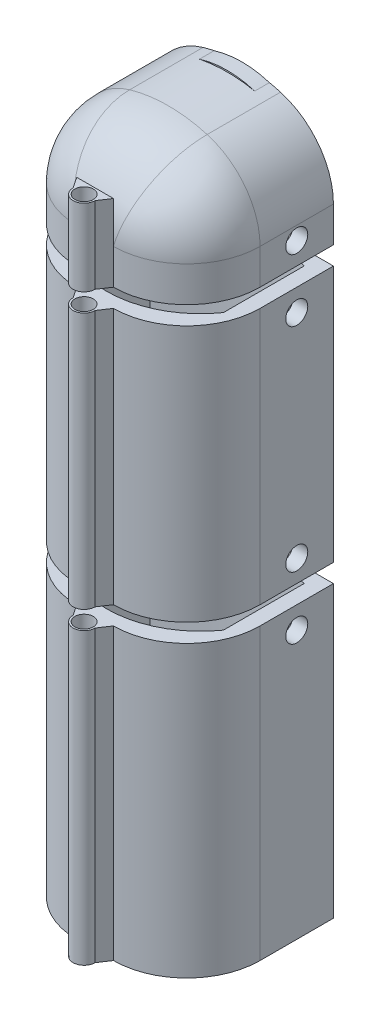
SolidWorks part; units mm, degrees
ref_plane "Alzado" through (0, 0, 0) normal (0, 0, 1) x (1, 0, 0)
ref_plane "Planta" through (0, 0, 0) normal (0, 1, 0) x (1, 0, 0)
ref_plane "Vista lateral" through (0, 0, 0) normal (1, 0, 0) x (0, 0, -1)
sketch "Croquis1" plane through (0, 0, 0) normal (0, 0, 1) x (1, 0, 0)
  line L1 (-18.6681, -47.5) -> (6.3319, -47.5)
  line L2 (-18.6681, -47.5) -> (-18.6681, 42.5)
  line L4 (6.3319, -47.5) -> (6.3319, 42.5)
  arc A0 (-18.6681, 42.5) -> (6.3319, 42.5) centre (-6.1681, 28.2195) cw
  point P0 (-2.2125, 0)
  dimension "D1" = 90
  dimension "D2" = 25
  dimension "D3" = 90
extrude "Saliente-Extruir1" add sketch "Croquis1" along normal blind 20
fillet "Redondeo1" radius 10 2 edges at (-18.6681, 42.5, 10) (6.3319, 42.5, 10)
fillet "Redondeo2" radius 10 5 edges at (-18.6681, -5.3285, 20) (-16.6633, 42.8494, 20) (-6.1681, 47.198, 20) (4.327, 42.8494, 20) (6.3319, -5.3285, 20)
sketch "Croquis2" plane through (0, 0, 20) normal (0, 0, 1) x (1, 0, 0)
  line L0 (-18.6681, 32.0235) -> (6.3319, 32.0235)
  line L4 (6.3319, 36.8429) -> (6.3319, -47.5) construction
  line L5 (-18.6681, -47.5) -> (-18.6681, 36.8429) construction
  line L7 (6.3319, 32.0235) -> (6.3319, 29.5235)
  line L8 (6.3319, 29.5235) -> (-18.6681, 29.5235)
  line L9 (-18.6681, 32.0235) -> (-18.6681, 29.5235)
  line L13 (6.3319, -5.4765) -> (-18.6681, -5.4765)
  line L14 (6.3319, -5.4765) -> (6.3319, -7.9765)
  line L15 (6.3319, -7.9765) -> (-18.6681, -7.9765)
  line L16 (-18.6681, -5.4765) -> (-18.6681, -7.9765)
  dimension "D2" = 2.5
  dimension "D4" = 2.5
extrude "Cortar-Extruir1" cut sketch "Croquis2" against normal blind 20
sketch "Croquis4" plane through (0, 0, 0) normal (0, 0, -1) x (-1, 0, 0)
  line L0 (18.6681, -47.5) -> (-6.3319, -47.5) construction
  line L2 (-4.3319, 37.5) -> (-4.3319, -47.5)
  line L3 (-4.3319, -47.5) -> (16.6681, -47.5)
  line L4 (16.6681, 32.5) -> (16.6681, -47.5)
  line L5 (-6.3319, -5.4765) -> (-6.3319, 29.5235) construction
  line L6 (18.6681, 29.5235) -> (18.6681, -5.4765) construction
  arc A0 (-4.3319, 37.5) -> (16.6681, 32.5) centre (6.1681, 35) cw
  dimension "D1" = 2
  dimension "D2" = 2
  dimension "D3" = 80
extrude "Cortar-Extruir2" cut sketch "Croquis4" against normal blind 13
sketch "Croquis6" plane through (0, -47.5, 0) normal (0, -1, 0) x (1, 0, 0)
  line L0 (-8.6681, 20) -> (-3.6681, 20) construction
  line L1 (-7.6681, 21.5) -> (-8.6681, 20)
  line L2 (-4.6681, 21.5) -> (-3.6681, 20)
  line L3 (-3.6681, 20) -> (-8.6681, 20)
  line L8 (-3.6681, 0) -> (-8.6681, 0)
  line L9 (-4.6681, -1.5) -> (-3.6681, 0)
  line L10 (-7.6681, -1.5) -> (-8.6681, 0)
  arc A0 (-4.6681, 21.5) -> (-7.6681, 21.5) centre (-6.1681, 21.5) ccw
  arc A1 (6.3319, 10) -> (-3.6681, 20) centre (-3.6681, 10) ccw construction
  arc A2 (-4.6681, -1.5) -> (-7.6681, -1.5) centre (-6.1681, -1.5) cw
  dimension "D1" = 3
  dimension "D2" = 1.5
extrude "Saliente-Extruir2" add sketch "Croquis6" against normal blind 90
sketch "Croquis7" plane through (0, -47.5, 0) normal (0, -1, 0) x (1, 0, 0)
  circle A0 centre (-6.1681, 21.5) radius 1.25
  dimension "D1" = 2.5
extrude "Cortar-Extruir3" cut sketch "Croquis7" against normal blind 90
sketch "Croquis8" plane through (0, 0, 0) normal (0, 0, -1) x (-1, 0, 0)
  line L1 (-6.3319, 32.0235) -> (18.6681, 32.0235)
  line L2 (-6.3319, 32.0235) -> (-6.3319, 29.5235)
  line L3 (-6.3319, 29.5235) -> (18.6681, 29.5235)
  line L4 (18.6681, 32.0235) -> (18.6681, 29.5235)
  line L5 (-6.3319, -5.4765) -> (18.6681, -5.4765)
  line L6 (-6.3319, -5.4765) -> (-6.3319, -7.9765)
  line L7 (-6.3319, -7.9765) -> (18.6681, -7.9765)
  line L8 (18.6681, -5.4765) -> (18.6681, -7.9765)
extrude "Cortar-Extruir5" cut sketch "Croquis8" against normal through all both and the other way through all
sketch "Croquis9" plane through (6.3319, 0, 0) normal (1, 0, 0) x (0, 0, -1)
  line L0 (-5, 35.0235) -> (-5, -47.5) construction
  line L1 (-10, -47.5) -> (0, -47.5) construction
  line L2 (0, 32.0235) -> (-10, 32.0235) construction
  line L3 (0, 29.5235) -> (-10, 29.5235) construction
  line L4 (0, -5.4765) -> (-10, -5.4765) construction
  line L5 (0, -7.9765) -> (-10, -7.9765) construction
  circle A0 centre (-5, 35.0235) radius 1.5
  circle A1 centre (-5, 26.5235) radius 1.5
  circle A2 centre (-5, -2.4765) radius 1.5
  circle A3 centre (-5, -10.9765) radius 1.5
  dimension "D1" = 3
  dimension "D3" = 3
  dimension "D5" = 3
  dimension "D7" = 3
  dimension "D2" = 3
  dimension "D4" = 3
  dimension "D6" = 3
  dimension "D8" = 3
extrude "Cortar-Extruir6" cut sketch "Croquis9" against normal blind 33
sketch "Croquis11" plane through (0, 0, 0) normal (0, 0, -1) x (-1, 0, 0)
  line L0 (-6.3319, 36.8429) -> (-6.3319, 32.0235)
  line L1 (-6.3319, 32.0235) -> (18.6681, 32.0235)
  line L3 (-6.3319, 29.5235) -> (18.6681, 29.5235)
  line L4 (18.6681, 29.5235) -> (18.6681, -5.4765)
  line L5 (18.6681, -5.4765) -> (-6.3319, -5.4765)
  line L6 (-6.3319, -5.4765) -> (-6.3319, 29.5235)
  line L7 (-6.3319, -7.9765) -> (18.6681, -7.9765)
  line L8 (18.6681, -7.9765) -> (18.6681, -47.5)
  line L9 (18.6681, -47.5) -> (-6.3319, -47.5)
  line L10 (-6.3319, -47.5) -> (-6.3319, -7.9765)
  line L11 (18.6681, 36.8429) -> (18.6681, 32.0235) construction
  line L12 (18.6681, 36.8429) -> (18.6681, 32.0235)
  arc A1 (-6.3319, 36.8429) -> (18.6681, 36.8429) centre (6.1681, 34.7133) cw
extrude "Saliente-Extruir3" add sketch "Croquis11" against normal blind 2
sketch "Croquis12" plane through (0, -47.5, 0) normal (0, -1, 0) x (1, 0, 0)
  line L0 (4.3319, 2) -> (-16.6681, 2) construction
  line L1 (-16.6681, 2) -> (4.3319, 2)
  arc A0 (-16.6681, 2) -> (4.3319, 2) centre (-6.1681, 37.7609) ccw
extrude "Cortar-Extruir7" cut sketch "Croquis12" against normal blind 90
sketch "Croquis13" plane through (0, -47.5, 0) normal (0, -1, 0) x (1, 0, 0)
  line L0 (-16.6681, 13) -> (4.3319, 13)
  arc A0 (-16.6681, 13) -> (4.3319, 13) centre (-6.1681, 5.6243) cw
extrude "Cortar-Extruir8" cut sketch "Croquis13" against normal blind 88
sketch "Croquis15" plane through (0, 42.5, 0) normal (0, 1, 0) x (1, 0, 0)
  circle A0 centre (-6.1681, 1.5) radius 1.25
  dimension "D1" = 2.5
extrude "Cortar-Extruir9" cut sketch "Croquis15" against normal blind 90
sketch "Croquis16" plane through (0, -47.5, 0) normal (0, -1, 0) x (1, 0, 0)
  circle A0 centre (-6.1681, -1.5) radius 1.25
  dimension "D1" = 2.5
extrude "Cortar-Extruir10" cut sketch "Croquis16" against normal blind 90
